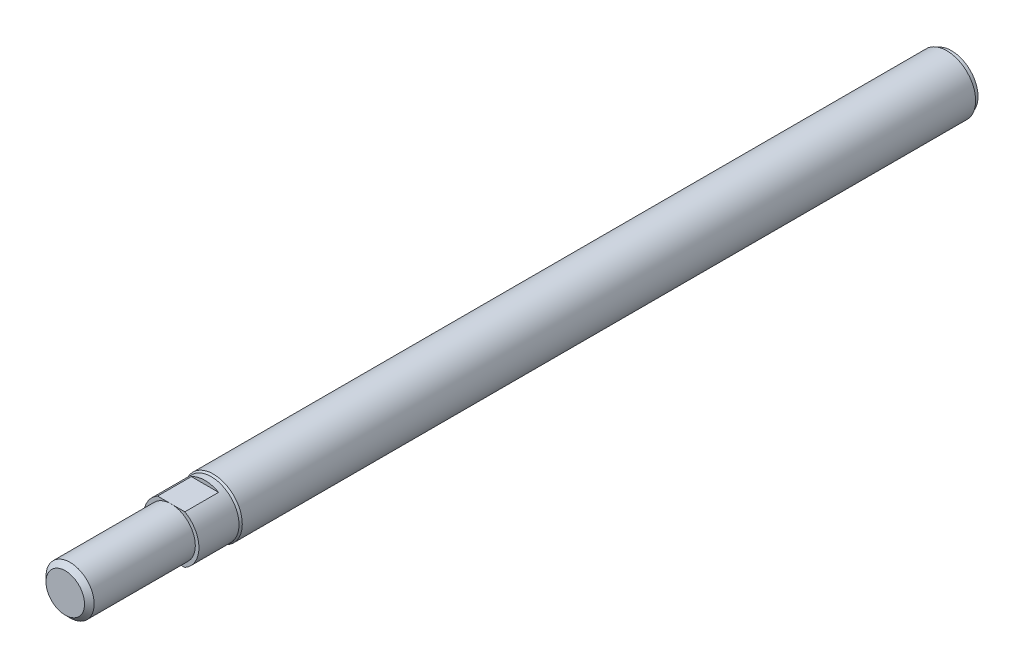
SolidWorks part; units mm, degrees
ref_plane "Plano frontal" through (0, 0, 0) normal (0, 0, 1) x (1, 0, 0)
ref_plane "Plano superior" through (0, 0, 0) normal (0, 1, 0) x (1, 0, 0)
ref_plane "Plano direito" through (0, 0, 0) normal (1, 0, 0) x (0, 0, -1)
sketch "Esboço1" plane through (0, 0, 0) normal (0, 0, 1) x (1, 0, 0)
  circle A0 centre (0, 0) radius 6
  dimension "D1" = 12
extrude "Ressalto-extrusão1" add sketch "Esboço1" along normal blind 184
sketch "Esboço2" plane through (0, 0, 184) normal (0, 0, 1) x (1, 0, 0)
  circle A0 centre (0, 0) radius 5
  dimension "D1" = 10
extrude "Corte-extrusão1" cut sketch "Esboço2" against normal blind 22 flip side to cut
chamfer "Chanfro1" distance 1 angle 45 1 edges at (5, 0, 184)
sketch "Esboço3" plane through (0, 0, 162) normal (0, 0, 1) x (1, 0, 0)
  line L1 (-9.1195, -5.005) -> (9.1195, -5.005)
  line L2 (-9.1195, -5.005) -> (-9.1195, 5.005)
  line L3 (-9.1195, 5.005) -> (9.1195, 5.005)
  line L4 (9.1195, -5.005) -> (9.1195, 5.005)
  line L5 (-9.1195, -5.005) -> (9.1195, 5.005) construction
  line L6 (-9.1195, 5.005) -> (9.1195, -5.005) construction
  point P0 (0, 0)
  dimension "D1" = 10.01
extrude "Corte-extrusão2" cut sketch "Esboço3" against normal blind 7 flip side to cut
sketch "Esboço4" plane through (0, 0, 0) normal (0, 0, -1) x (-1, 0, 0)
  circle A0 centre (0, 0) radius 5.5
  dimension "D1" = 11
extrude "Corte-extrusão3" cut sketch "Esboço4" against normal blind 1 flip side to cut
hole_wizard "Furo roscado de M6x1.01" positions "Esboço5" profile "Esboço6" tap size "M6x1.0" standard "Ansi Metric"
sketch "Esboço5" plane through (0, 0, 0) normal (0, 0, -1) x (-1, 0, 0)
  point P0 (0, 0)
sketch "Esboço6" plane through (0, 0, 0) normal (1, 0, 0) x (0, 1, 0)
  line L0 (0, 0) -> (0, 18.5022)
  line L1 (0, 18.5022) -> (2.5, 17)
  line L2 (2.5, 17) -> (2.5, 0)
  line L5 (2.5, 0) -> (0, 0)
  line L10 (0, 18.5022) -> (-2.5, 17) construction
  line L11 (0, -6.35) -> (0, 107.95) construction
  dimension "Tap Drill Dia." = 5
  dimension "Tap Drill Depth" = 17
  dimension "Drill Angle" = 118
sketch "Esboço7" plane through (0, 0, 162) normal (0, 0, 1) x (1, 0, 0)
  circle A0 centre (0, 0) radius 5.75
  dimension "D1" = 11.5
extrude "Corte-extrusão4" cut sketch "Esboço7" against normal blind 8 flip side to cut
chamfer "Chanfro2" distance 0.75 angle 30 1 edges at (6, 0, 154)
